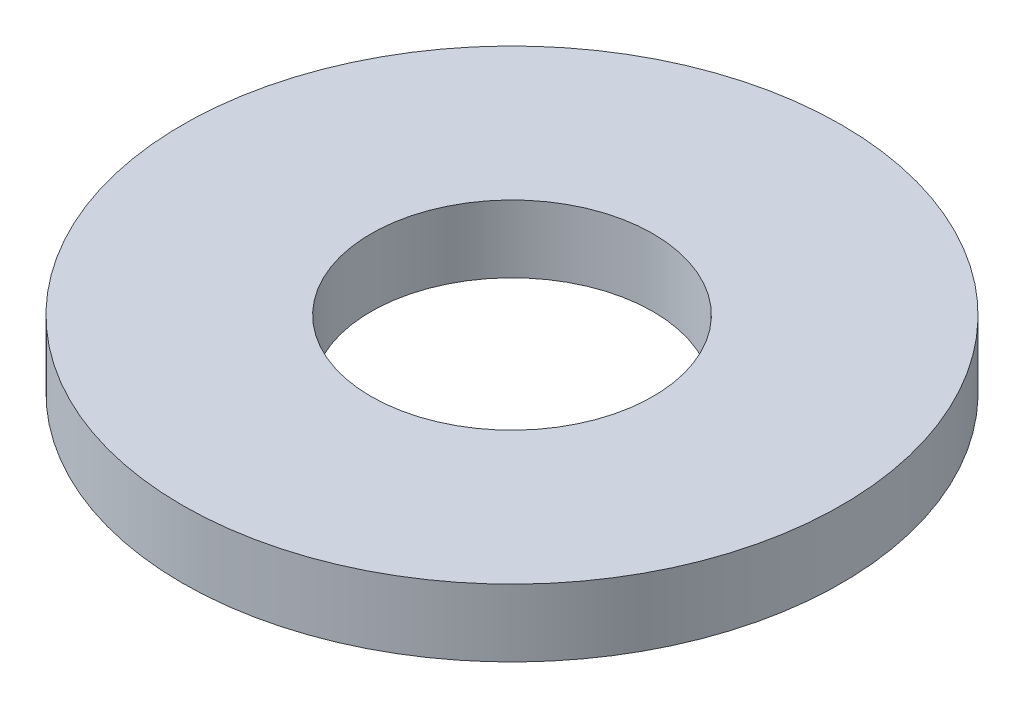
SolidWorks part; units mm, degrees
ref_plane "Front Plane" through (0, 0, 0) normal (0, 0, 1) x (1, 0, 0)
ref_plane "Top Plane" through (0, 0, 0) normal (0, 1, 0) x (1, 0, 0)
ref_plane "Right Plane" through (0, 0, 0) normal (1, 0, 0) x (0, 0, -1)
sketch "Sketch1" plane through (0, 0, 0) normal (0, 0, 1) x (1, 0, 0)
  line L0 (0, 0) -> (0, 22.9368) construction
  line L1 (-11.7602, 0) -> (-9.5631, 0)
  line L2 (-11.7602, 0) -> (-11.7602, 1.8057)
  line L3 (-11.7602, 1.8057) -> (-13.9192, 1.8057)
  line L4 (-13.9192, 1.8057) -> (-13.9192, 0)
  line L5 (-13.9192, 0) -> (-22.352, 0)
  line L6 (-22.352, 0) -> (-22.352, 4.572)
  line L7 (-22.352, 4.572) -> (-9.5631, 4.572)
  line L8 (-9.5631, 0) -> (-9.5631, 4.572)
  dimension "D1" = 19.1262
  dimension "D2" = 23.5204
  dimension "D3" = 2.159
  dimension "D4" = 44.704
revolve "Revolve1" add sketch "Sketch1" angle 360 about L0
